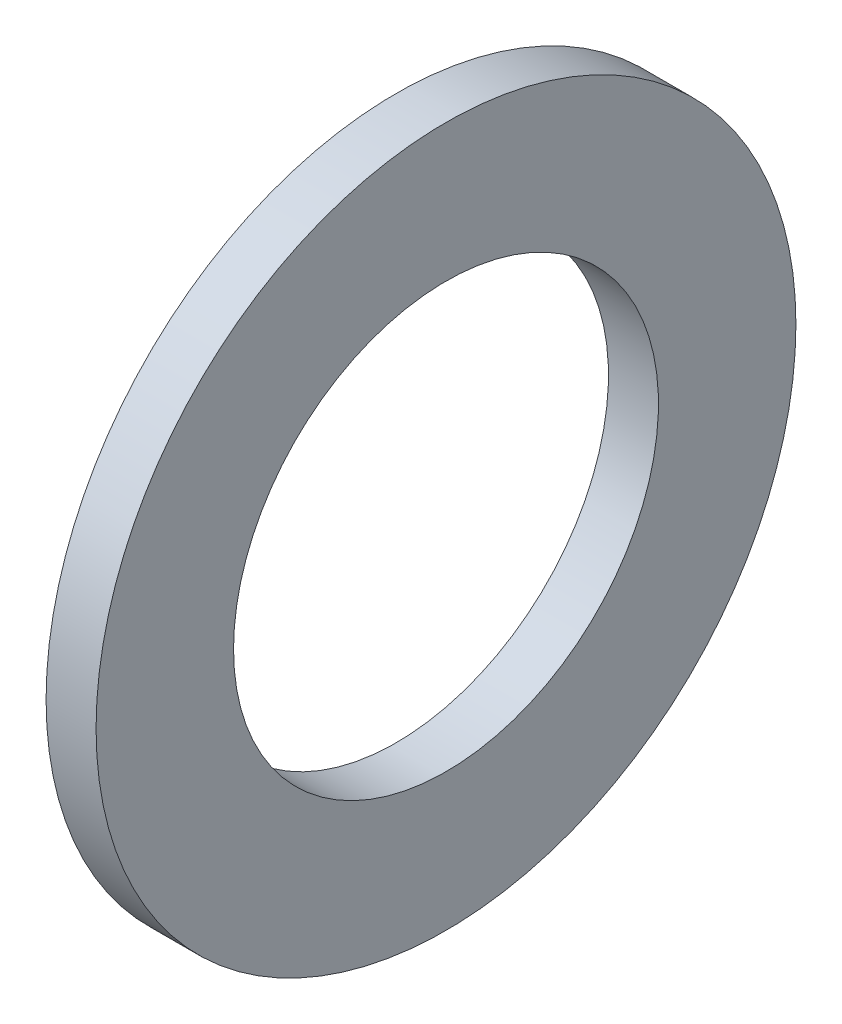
SolidWorks part; units mm, degrees
ref_plane "Plan1" through (0, 0, 0) normal (0, 0, 1) x (1, 0, 0)
ref_plane "Plan2" through (0, 0, 0) normal (0, 1, 0) x (1, 0, 0)
ref_plane "Plan3" through (0, 0, 0) normal (1, 0, 0) x (0, 0, -1)
sketch "Esquisse1" plane through (0, 0, 0) normal (0, 0, 1) x (1, 0, 0)
  line L0 (0, 0) -> (2, 0) construction
  line L1 (0, 14) -> (2, 14)
  line L2 (0, 14) -> (0, 8.5)
  line L3 (0, 8.5) -> (2, 8.5)
  line L4 (2, 14) -> (2, 8.5)
  dimension "D1" = 17
  dimension "D2" = 28
  dimension "D3" = 2
revolve "Base-Révolution" add sketch "Esquisse1" angle 360 about L0
